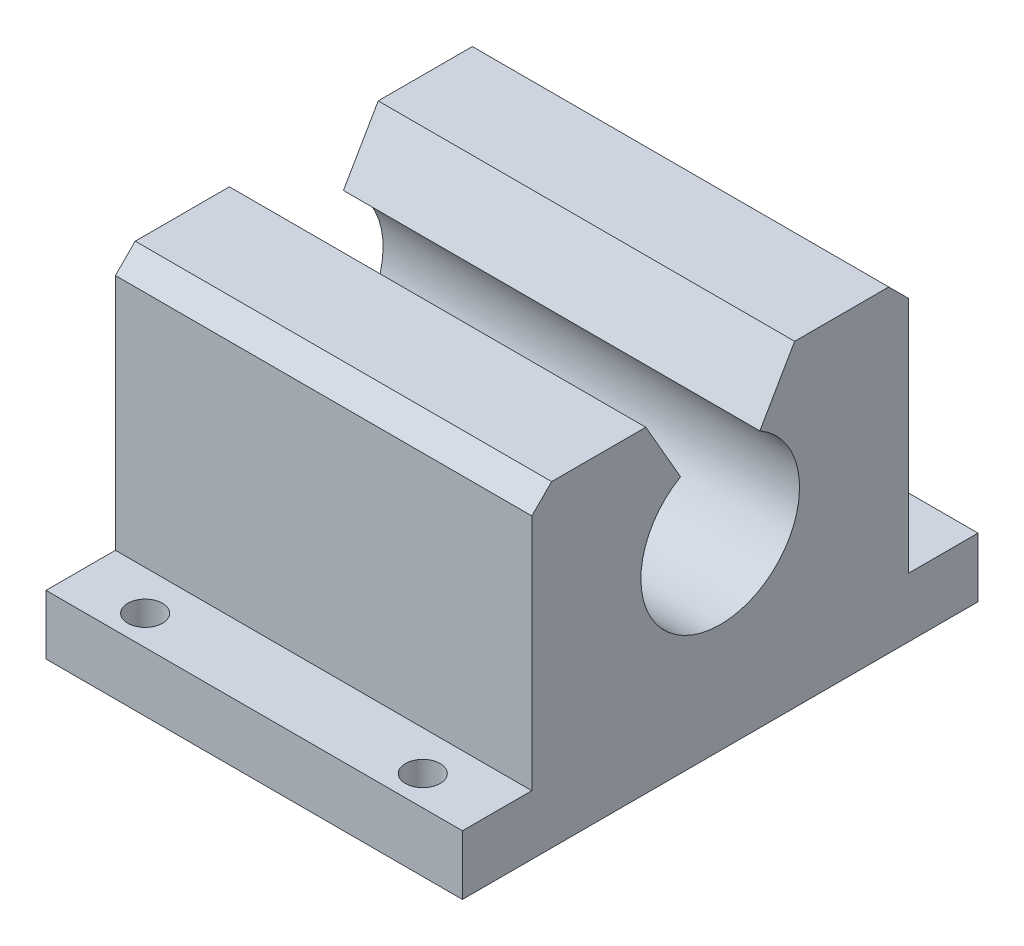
SolidWorks part; units mm, degrees
ref_plane "front" through (0, 0, 0) normal (0, 0, 1) x (1, 0, 0)
ref_plane "top" through (0, 0, 0) normal (0, 1, 0) x (1, 0, 0)
ref_plane "side" through (0, 0, 0) normal (1, 0, 0) x (0, 0, -1)
sketch "Sketch1" plane through (0, 0, 0) normal (1, 0, 0) x (0, 0, -1)
  line L0 (0, 0) -> (0, 82.55) construction
  line L1 (-41.275, 0) -> (41.275, 0)
  line L2 (41.275, 0) -> (41.275, 9.525)
  line L3 (41.275, 9.525) -> (30.1625, 9.525)
  line L4 (30.1625, 9.525) -> (30.1625, 50.8)
  line L5 (-30.1625, 50.8) -> (30.1625, 50.8)
  line L7 (-30.1625, 9.525) -> (-30.1625, 50.8)
  line L8 (-41.275, 9.525) -> (-30.1625, 9.525)
  line L9 (-41.275, 0) -> (-41.275, 9.525)
  circle A1 centre (0, 30.1625) radius 12.7
  point P14 (0, 0)
  dimension "D2" = 30.1625
  dimension "D3" = 25.4
  dimension "D1" = 82.55
  dimension "D4" = 50.8
  dimension "D7" = 9.525
extrude "Base-Extrude" add sketch "Sketch1" along normal blind 66.675
sketch "Sketch2" plane through (0, 9.525, 0) normal (0, 1, 0) x (-1, 0, 0)
  line L0 (-66.675, 41.275) -> (-66.675, 30.1625) construction
  line L1 (-66.675, 41.275) -> (0, 41.275) construction
  circle A0 centre (-55.5625, 36.5125) radius 2.7781
  dimension "D1" = 5.5562
  dimension "D2" = 11.1125
  dimension "D3" = 4.7625
extrude "Cut-Extrude1" cut sketch "Sketch2" against normal through all
pattern_linear "LPattern1" count 2 spacing 44.45 along (-1, 0, 0) count 2 spacing 73.025 along (0, 0, -1) of "Cut-Extrude1"
sketch "Sketch3" plane through (66.675, 0, 0) normal (1, 0, 0) x (0, 0, -1)
  line L0 (0, 30.1625) -> (0, 55.5587) construction
  line L1 (11.9151, 50.8) -> (-11.9151, 50.8)
  line L2 (-30.1625, 50.8) -> (30.1625, 50.8) construction
  line L3 (11.9151, 50.8) -> (0, 30.1625)
  line L4 (-11.9151, 50.8) -> (0, 30.1625)
  point P8 (0, 50.8)
  dimension "D1" = 60
extrude "Cut-Extrude2" cut sketch "Sketch3" against normal through all
chamfer "Chamfer1" distance 3.175 angle 45 2 edges at (33.3375, 50.8, 30.1625) (33.3375, 50.8, -30.1625)
